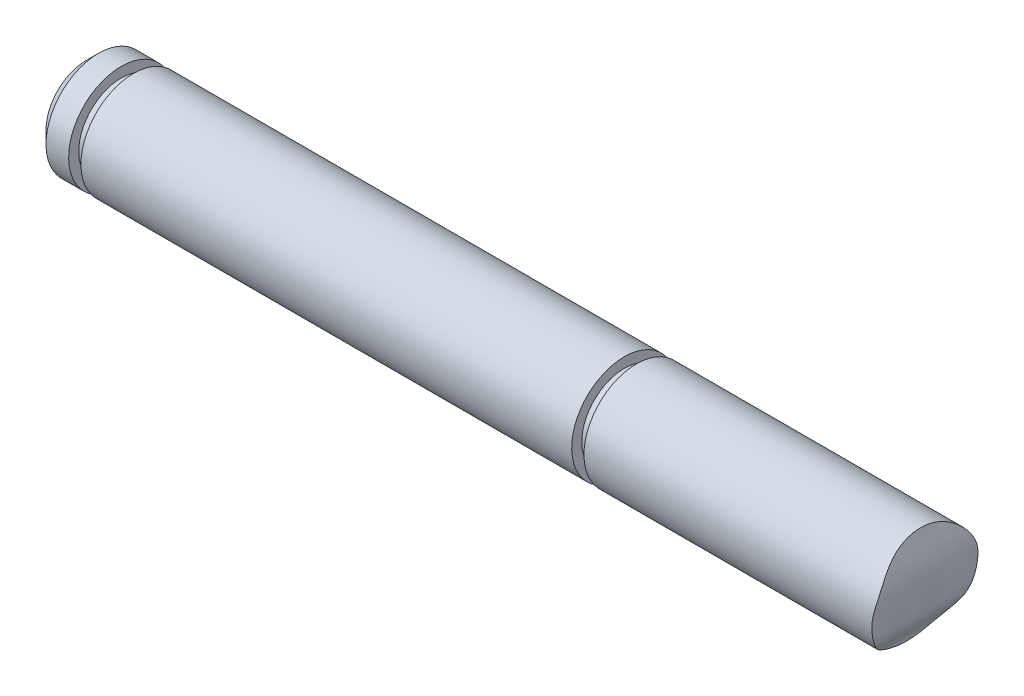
SolidWorks part; units mm, degrees
ref_plane "Plan de face" through (0, 0, 0) normal (0, 0, 1) x (1, 0, 0)
ref_plane "Plan de dessus" through (0, 0, 0) normal (0, 1, 0) x (1, 0, 0)
ref_plane "Plan de droite" through (0, 0, 0) normal (1, 0, 0) x (0, 0, -1)
sketch "Esquisse1" plane through (0, 0, 0) normal (0, 0, 1) x (1, 0, 0)
  line L0 (-31.9027, 5.2136) -> (-31.9027, 7.5065)
  line L1 (-31.9027, 7.5065) -> (-31.1956, 8.2136)
  line L2 (-31.1956, 8.2136) -> (-29.9027, 8.2136)
  line L3 (-29.9027, 8.2136) -> (-29.9027, 7.6386)
  line L4 (-29.9027, 7.6386) -> (-29.2027, 7.6386)
  line L5 (-29.2027, 7.6386) -> (-29.2027, 8.2136)
  line L6 (-29.2027, 8.2136) -> (-1.2027, 8.2136)
  line L7 (-1.2027, 8.2136) -> (-1.2027, 7.6386)
  line L8 (-0.5027, 7.6386) -> (-0.5027, 8.2136)
  line L9 (-0.5027, 8.2136) -> (19.4973, 8.2136)
  line L10 (19.4973, 8.2136) -> (19.4973, 5.2136)
  line L11 (19.4973, 5.2136) -> (-31.9027, 5.2136)
  line L12 (-1.2027, 7.6386) -> (-0.5027, 7.6386)
  dimension "D1" = 0.7
  dimension "D2" = 0.7
  dimension "D3" = 28
  dimension "D4" = 2.425
  dimension "D5" = 2.425
  dimension "D6" = 3
  dimension "D7" = 3
  dimension "D8" = 3
  dimension "D9" = 1
  dimension "D10" = 45
  dimension "D11" = 2
  dimension "D12" = 20
revolve "Révolution1" add sketch "Esquisse1" angle 360 about L11
sketch "Esquisse2" plane through (0, 0, 0) normal (0, 0, 1) x (1, 0, 0)
  spline S0 degree 3 poles (16.4295, 10.7172) (16.0378, 10.1421) (15.1924, 8.9009) (16.3145, 6.9545) (15.878, 5.1405) (15.82, 3.5105) (14.6219, 2.3077) (15.1402, 0.7705) (15.8471, 0.2393) (16.1657, 0) knots 0 0 0 0 0.167311 0.361093 0.503162 0.642417 0.771289 0.89695 1 1 1 1
extrude "Enlèv. mat.-Extru.1" cut sketch "Esquisse2" against normal through all and the other way through all
